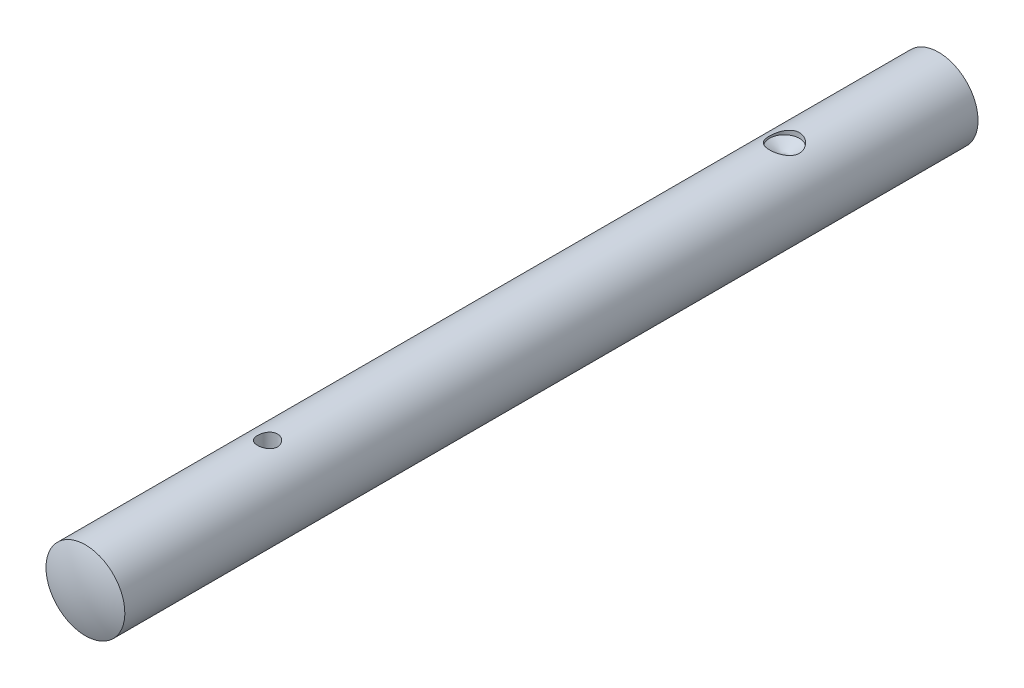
SolidWorks part; units mm, degrees
ref_plane "正面" through (0, 0, 0) normal (0, 0, 1) x (1, 0, 0)
ref_plane "平面" through (0, 0, 0) normal (0, 1, 0) x (1, 0, 0)
ref_plane "右側面" through (0, 0, 0) normal (1, 0, 0) x (0, 0, -1)
sketch "ｽｹｯﾁ1" plane through (0, 0, 0) normal (0, 0, 1) x (1, 0, 0)
  circle A0 centre (0, 0) radius 7.9
  dimension "D1" = 15.8
extrude "ﾎﾞｽ - 押し出し1" add sketch "ｽｹｯﾁ1" against normal blind 174
ref_plane "平面1" through (0, 7.9, 0) normal (0, 1, 0) x (1, 0, 0)
hole_wizard "Ø4.0 (4) 直径の穴1" positions "ｽｹｯﾁ3" profile "ｽｹｯﾁ2" hole size "Ø4.0" standard "Jis"
sketch "ｽｹｯﾁ3" plane through (0, 7.9, 0) normal (0, 1, 0) x (1, 0, 0)
  line L0 (0, 0) -> (0, 38) construction
  point P2 (0, 38)
  dimension "D1" = 38
sketch "ｽｹｯﾁ2" plane through (0, 7.9, -38) normal (1, 0, 0) x (0, 0, 1)
  line L0 (0, 0) -> (0, 6.2017)
  line L1 (0, 6.2017) -> (2, 5)
  line L2 (2, 5) -> (2, 0)
  line L5 (2, 0) -> (0, 0)
  line L10 (0, 6.2017) -> (-2, 5) construction
  line L11 (0, -6.35) -> (0, 107.95) construction
  dimension "穴の直径" = 4
  dimension "穴の深さ" = 5
  dimension "ﾄﾞﾘﾙ角度" = 118
hole_wizard "Ø6.0 (6) 直径の穴1" positions "ｽｹｯﾁ5" profile "ｽｹｯﾁ4" hole size "Ø6.0" standard "Jis"
sketch "ｽｹｯﾁ5" plane through (0, 7.9, 0) normal (0, 1, 0) x (1, 0, 0)
  line L2 (0, 174) -> (0, 141.6) construction
  line L3 (7.9, 174) -> (-7.9, 174) construction
  point P8 (0, 141.6)
  dimension "D1" = 32.4
sketch "ｽｹｯﾁ4" plane through (0, 7.9, -141.6) normal (1, 0, 0) x (0, 0, 1)
  line L0 (0, 0) -> (0, 2.8026)
  line L1 (0, 2.8026) -> (3, 1)
  line L2 (3, 1) -> (3, 0)
  line L5 (3, 0) -> (0, 0)
  line L10 (0, 2.8026) -> (-3, 1) construction
  line L11 (0, -6.35) -> (0, 107.95) construction
  dimension "穴の直径" = 6
  dimension "穴の深さ" = 1
  dimension "ﾄﾞﾘﾙ角度" = 118
sketch "s-ヤキバメ" plane through (0, 0, 0) normal (1, 0, 0) x (0, 0, -1)
  line L0 (0, 0) -> (75.6592, 0) construction
  line L1 (19.5, -21) -> (56.5, -21)
  line L2 (19.5, -21) -> (19.5, 21)
  line L3 (19.5, 21) -> (56.5, 21)
  line L4 (56.5, -21) -> (56.5, 21)
  line L5 (19.5, -13.13) -> (56.5, -13.13)
  line L6 (19.5, -17.5) -> (56.5, -17.5)
  line L7 (19.5, 17.5) -> (56.5, 17.5)
  line L8 (19.5, 13.13) -> (56.5, 13.13)
  point P6 (19.5, 0)
  dimension "D1" = 18.5
  dimension "D2" = 37
  dimension "D3" = 42
  dimension "D4" = 7.87
  dimension "D5" = 35
sketch "s-先端輪郭1" plane through (0, 0, 0) normal (1, 0, 0) x (0, 0, -1)
  line L0 (1.5, 7.9) -> (1.5, -7.9) construction
  line L1 (36, 7.9) -> (0, 7.9) construction
  line L2 (0, -7.9) -> (174, -7.9) construction
  line L3 (0, 7.9) -> (0, -7.9) construction
  arc A0 (1.5, 7.9) -> (1.5, -7.9) centre (21.5533, 0) ccw
  dimension "D1" = 1.5
sketch "s-先端輪郭2" plane through (0, 0, 0) normal (1, 0, 0) x (0, 0, -1)
  line L0 (172.5, 7.9) -> (172.5, -7.9) construction
  line L1 (174, 7.9) -> (144.6, 7.9) construction
  line L2 (0, -7.9) -> (174, -7.9) construction
  line L3 (174, -7.9) -> (174, 7.9) construction
  arc A0 (172.5, 7.9) -> (172.5, -7.9) centre (152.4467, 0) cw
  dimension "D1" = 1.5
sketch "ｽｹｯﾁ9" plane through (0, 0, 0) normal (1, 0, 0) x (0, 0, -1)
  arc A0 (1.5, 7.9) -> (1.5, -7.9) centre (21.5533, 0) ccw construction
  arc A2 (0, 0) -> (1.5, -7.9) centre (21.5533, 0) ccw
other "ｶｯﾄ-回転-薄板1" parameters "D1"=360, "D3"=10, "D4"=10, "D7"=0
sketch "ｽｹｯﾁ10" plane through (0, 0, 0) normal (1, 0, 0) x (0, 0, -1)
  line L0 (174, -7.9) -> (174, 7.9) construction
  arc A0 (172.5, -7.9) -> (172.5, 7.9) centre (152.4467, 0) ccw construction
  arc A2 (172.5, -7.9) -> (174, 0) centre (152.4467, 0) ccw
other "ｶｯﾄ-回転-薄板2" parameters "D1"=360, "D3"=10, "D4"=10, "D7"=0
